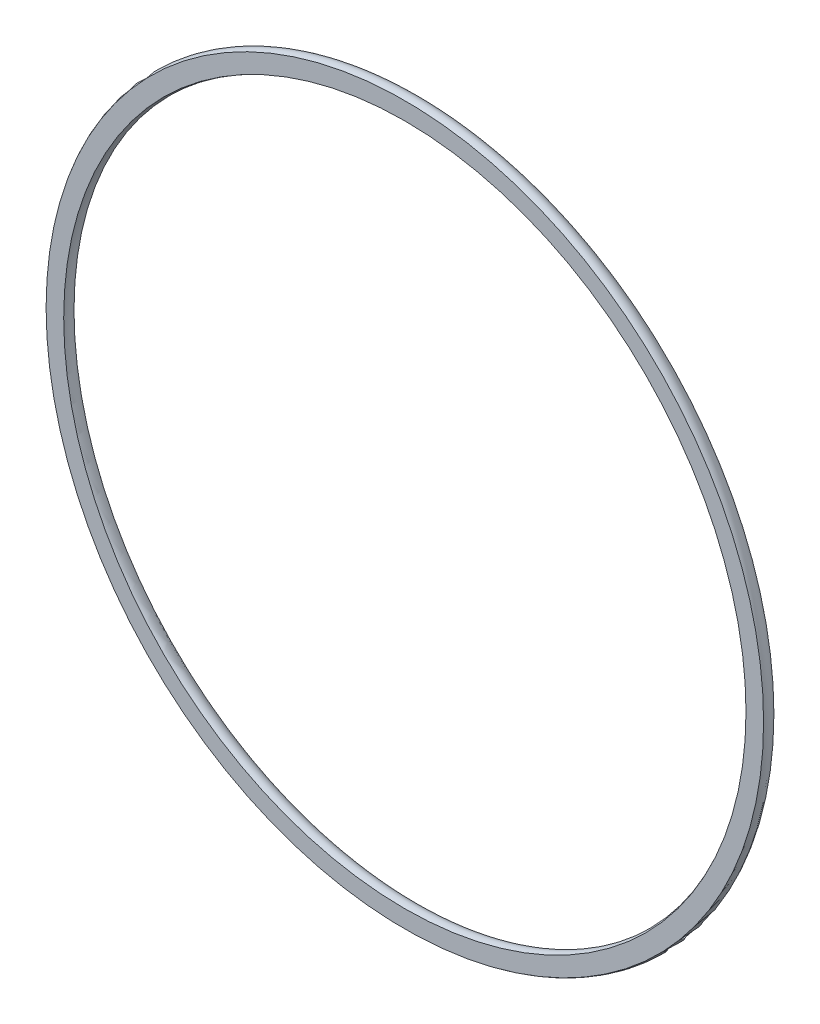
SolidWorks part; units mm, degrees
ref_plane "Front" through (0, 0, 0) normal (0, 0, 1) x (1, 0, 0)
ref_plane "Top" through (0, 0, 0) normal (0, 1, 0) x (1, 0, 0)
ref_plane "Right" through (0, 0, 0) normal (1, 0, 0) x (0, 0, -1)
sketch "Sketch1" plane through (0, 0, 0) normal (1, 0, 0) x (0, -1, 0)
  line L0 (0, -0.889) -> (0, 0.889) construction
  line L2 (-34.9809, 0) -> (34.9809, 0) construction
  line L3 (-30.0228, 0) -> (30.0228, 0) construction
  circle A0 centre (30.9118, 0) radius 0.889
  point P9 (30.0228, 0)
  point P10 (31.8008, 0)
  point P13 (30.9118, 0.889)
  point P14 (30.9118, -0.889)
  dimension "Width" = 1.778
  dimension "ID" = 60.0456
revolve "Revolve1" add sketch "Sketch1" angle 360 about L0
ref_plane "Plane1" through (0, 0, 0.889) normal (0, 0, 1) x (1, 0, 0)
sketch "Sketch2" plane through (0, 0, 0.889) normal (0, 0, 1) x (1, 0, 0)
  line L1 (-39.3355, -36.2604) -> (41.3001, -36.2604)
  line L2 (-39.3355, -36.2604) -> (-39.3355, 35.9614)
  line L3 (-39.3355, 35.9614) -> (41.3001, 35.9614)
  line L4 (41.3001, -36.2604) -> (41.3001, 35.9614)
extrude "Cut-Extrude1" cut sketch "Sketch2" against normal blind 0.4572
